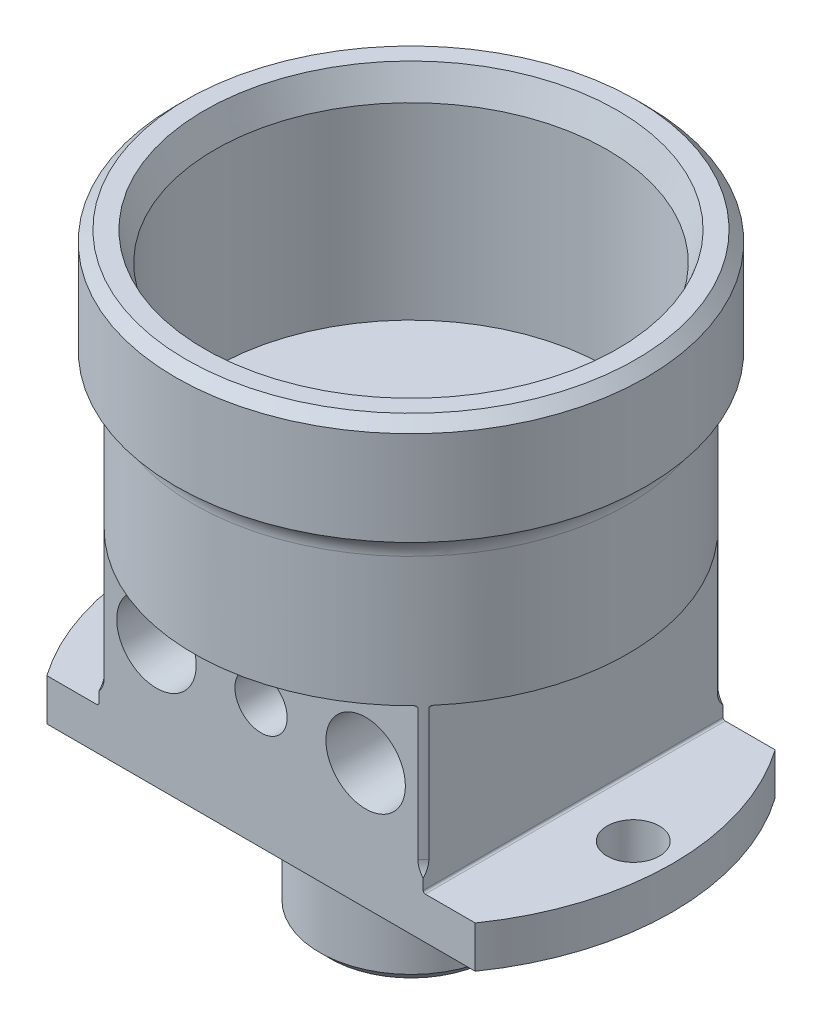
SolidWorks part; units mm, degrees
ref_plane "Front Plane" through (0, 0, 0) normal (0, 0, 1) x (1, 0, 0)
ref_plane "Top Plane" through (0, 0, 0) normal (0, 1, 0) x (1, 0, 0)
ref_plane "Right Plane" through (0, 0, 0) normal (1, 0, 0) x (0, 0, -1)
sketch "layout" plane through (0, 0, 0) normal (0, 0, 1) x (1, 0, 0)
  line L0 (0, 6.6796) -> (0, 55.0831) construction
  line L1 (0, 0) -> (26.3525, 0)
  line L2 (26.3525, 0) -> (26.3525, 43.18)
  line L3 (26.3525, 43.18) -> (26.67, 43.18)
  line L4 (28.575, 45.085) -> (28.575, 53.975)
  line L5 (26.67, 43.18) -> (28.575, 45.085)
  line L6 (26.67, 55.88) -> (25.0825, 55.88)
  line L7 (25.0825, 55.88) -> (23.8125, 52.3907)
  line L8 (23.8125, 52.3907) -> (23.8125, 29.5307)
  line L9 (23.8125, 29.5307) -> (0, 29.5307)
  line L10 (26.67, 55.88) -> (28.575, 53.975)
  line L11 (0, 29.5307) -> (0, 0)
  line L12 (4.7752, 0) -> (4.7752, -15.875)
  line L13 (3.1877, 29.5307) -> (0, 29.5307)
  line L14 (3.1877, 29.5307) -> (3.1877, 20.6407)
  line L15 (3.1877, 20.6407) -> (0, 20.6407)
  line L16 (0, 29.5307) -> (0, 20.6407)
  line L17 (3.1877, 26.9907) -> (5.5626, 26.9907)
  line L18 (3.1877, 26.9907) -> (3.1877, 23.8157)
  line L19 (3.1877, 23.8157) -> (5.5626, 23.8157)
  line L20 (5.5626, 26.9907) -> (5.5626, 23.8157)
  line L21 (0, 20.6407) -> (4.7752, 20.6407)
  line L22 (0, 20.6407) -> (0, 0)
  line L23 (0, 0) -> (4.7752, 0)
  line L24 (4.7752, 20.6407) -> (4.7752, 0)
  line L25 (4.7752, -15.875) -> (9.8171, -15.875)
  line L26 (9.8171, -15.875) -> (11.0871, -14.605)
  line L27 (11.0871, -14.605) -> (11.0871, 0)
  line L28 (11.0871, 0) -> (4.7752, 0)
  line L29 (18.2086, 0) -> (18.2086, 23.1807)
  line L30 (0, 0) -> (50.8, 0) construction
  line L31 (0, 0) -> (0, -3.81) construction
  line L32 (0, -3.81) -> (50.8, -3.81) construction
  line L33 (50.8, 0) -> (50.8, -3.81) construction
  line L34 (12.7, 15.24) -> (12.7, 21.59) construction
  line L35 (0, 15.24) -> (19.05, 15.24) construction
  line L36 (18.2086, 15.24) -> (18.2086, -3.81) construction
  line L37 (19.4786, 24.4507) -> (26.3525, 24.4507)
  line L39 (26.3525, 0) -> (31.75, 0)
  line L40 (26.3525, 0) -> (26.3525, 5.08)
  line L41 (26.3525, 5.08) -> (31.75, 5.08)
  line L42 (31.75, 0) -> (31.75, 5.08)
  line L43 (22.225, 11.43) -> (31.75, 11.43)
  line L44 (22.225, 11.43) -> (22.225, 5.08)
  line L45 (22.225, 5.08) -> (31.75, 5.08)
  line L46 (31.75, 11.43) -> (31.75, 5.08)
  line L47 (23.8125, 5.08) -> (30.1625, 5.08)
  line L48 (23.8125, 5.08) -> (23.8125, -7.62)
  line L49 (23.8125, -7.62) -> (30.1625, -7.62)
  line L50 (30.1625, 5.08) -> (30.1625, -7.62)
  line L51 (4.7752, -8.7376) -> (7.9375, -8.7376)
  line L52 (4.7752, -8.7376) -> (4.7752, -12.7)
  line L53 (4.7752, -12.7) -> (7.9375, -12.7)
  line L54 (7.9375, -8.7376) -> (7.9375, -12.7)
  line L55 (11.0871, -3.175) -> (9.0551, -3.175)
  line L56 (11.0871, -3.175) -> (11.0871, -6.731)
  line L57 (11.0871, -6.731) -> (9.0551, -6.731)
  line L58 (9.0551, -3.175) -> (9.0551, -6.731)
  circle A0 centre (12.7, 15.24) radius 4.7625
  arc A1 (18.2086, 23.1807) -> (19.4786, 24.4507) centre (19.4786, 23.1807) cw
  circle A2 centre (12.7, 15.24) radius 6.35 construction
  circle A3 centre (0, 15.24) radius 26.3525 construction
  point P24 (4.3752, 23.8157)
  point P59 (26.9875, 5.08)
  point P60 (26.9875, 5.08)
  point P62 (26.9875, 11.43)
  dimension "D25" = 9.525
  dimension "D29" = 12.7
  dimension "D30" = 1.27
  dimension "D1" = 47.625
  dimension "D2" = 55.88
  dimension "D3" = 57.15
  dimension "D4" = 1.27
  dimension "D5" = 45
  dimension "D6" = 12.7
  dimension "D7" = 20
  dimension "D8" = 22.86
  dimension "D9" = 52.705
  dimension "D10" = 45
  dimension "D11" = 26.67
  dimension "D12" = 2.54
  dimension "D13" = 9.5504
  dimension "D14" = 6.3754
  dimension "D15" = 11.1252
  dimension "D16" = 3.175
  dimension "D17" = 2.54
  dimension "D18" = 3.175
  dimension "D19" = 20.6407
  dimension "D20" = 15.875
  dimension "D21" = 45
  dimension "D22" = 1.27
  dimension "D23" = 6.3119
  dimension "D24" = 2.2968
  dimension "D26" = 25.4
  dimension "D27" = 15.24
  dimension "D28" = 3.81
  dimension "D31" = 5.08
  dimension "D32" = 22.1742
  dimension "D33" = 5.08
  dimension "D34" = 63.5
  dimension "D35" = 6.35
  dimension "D36" = 9.525
  dimension "D37" = 53.975
  dimension "D38" = 6.35
  dimension "D39" = 12.7
  dimension "D40" = 50.8
  dimension "D41" = 15.875
  dimension "D42" = 3.9624
  dimension "D43" = 3.175
  dimension "D44" = 18.1102
  dimension "D45" = 3.556
  dimension "D46" = 3.175
sketch "reference_transfer" plane through (0, 0, 0) normal (0, 1, 0) x (1, 0, 0)
  line L0 (0, 0) -> (0, -18.2086) construction
  circle A0 centre (0, 0) radius 18.2086
sketch "Sketch27" plane through (0, 0, 0) normal (0, 0, 1) x (1, 0, 0)
  line L1 (23.8125, 52.3907) -> (23.8125, 29.5307) construction
  line L3 (26.3525, 0) -> (26.3525, 43.18) construction
  line L4 (26.3525, 43.18) -> (26.67, 43.18) construction
  line L6 (28.575, 45.085) -> (28.575, 53.975) construction
  line L8 (26.67, 55.88) -> (25.0825, 55.88) construction
  line L9 (25.0825, 55.88) -> (23.8125, 52.3907) construction
  line L10 (23.8125, 29.5307) -> (0, 29.5307) construction
  line L12 (23.8125, 52.3907) -> (23.8125, 29.5307)
  line L14 (26.3525, 5.08) -> (26.3525, 43.18)
  line L15 (26.3525, 43.18) -> (28.575, 43.18)
  line L17 (28.575, 43.18) -> (28.575, 55.88)
  line L19 (28.575, 55.88) -> (25.0825, 55.88)
  line L20 (25.0825, 55.88) -> (23.8125, 52.3907)
  line L21 (23.8125, 29.5307) -> (3.1877, 29.5307)
  line L23 (4.7752, -15.875) -> (9.8171, -15.875) construction
  line L24 (9.8171, -15.875) -> (11.0871, -14.605) construction
  line L25 (11.0871, -14.605) -> (11.0871, 0) construction
  line L28 (4.7752, -15.875) -> (9.8171, -15.875)
  line L29 (9.8171, -15.875) -> (11.0871, -14.605)
  line L30 (11.0871, -14.605) -> (11.0871, 0)
  line L32 (11.0871, 0) -> (26.3525, 0)
  line L33 (3.1877, 29.5307) -> (3.1877, 20.6407) construction
  line L38 (3.1877, 29.5307) -> (3.1877, 20.6407)
  line L39 (3.1877, 20.6407) -> (4.7752, 20.6407)
  line L43 (4.7752, 20.6407) -> (4.7752, -15.875)
  line L44 (26.3525, 5.08) -> (31.75, 5.08) construction
  line L46 (31.75, 0) -> (31.75, 5.08) construction
  line L47 (26.3525, 0) -> (31.75, 0) construction
  line L48 (26.3525, 5.08) -> (31.75, 5.08)
  line L50 (31.75, 0) -> (31.75, 5.08)
  line L51 (26.3525, 0) -> (31.75, 0)
revolve "Revolve1" add sketch "Sketch27" angle 360 about L0
sketch "Sketch42" plane through (0, 0, 0) normal (0, 0, 1) x (1, 0, 0)
  line L0 (5.5626, 26.9907) -> (5.5626, 23.8157) construction
  line L1 (3.1877, 23.8157) -> (5.5626, 23.8157) construction
  line L2 (3.1877, 26.9907) -> (3.1877, 23.8157) construction
  line L3 (3.1877, 26.9907) -> (5.5626, 26.9907) construction
  line L4 (5.5626, 26.9907) -> (5.5626, 23.8157)
  line L5 (3.1877, 23.8157) -> (5.5626, 23.8157)
  line L6 (3.1877, 26.9907) -> (3.1877, 23.8157)
  line L7 (3.1877, 26.9907) -> (5.5626, 26.9907)
revolve "cup_seal_groove" cut sketch "Sketch42" angle 360 about L0
sketch "Sketch43" plane through (0, 0, 0) normal (0, 0, 1) x (1, 0, 0)
  line L0 (11.0871, -6.731) -> (9.0551, -6.731) construction
  line L1 (9.0551, -3.175) -> (9.0551, -6.731) construction
  line L2 (11.0871, -3.175) -> (9.0551, -3.175) construction
  line L3 (11.0871, -3.175) -> (11.0871, -6.731) construction
  line L4 (11.0871, -6.731) -> (9.0551, -6.731)
  line L5 (9.0551, -3.175) -> (9.0551, -6.731)
  line L6 (11.0871, -3.175) -> (9.0551, -3.175)
  line L7 (11.0871, -3.175) -> (11.0871, -6.731)
revolve "o-ring_groove" cut sketch "Sketch43" angle 360 about L0
sketch "Sketch44" plane through (0, 0, 0) normal (0, 0, 1) x (1, 0, 0)
  line L0 (7.9375, -8.7376) -> (7.9375, -12.7) construction
  line L1 (4.7752, -12.7) -> (7.9375, -12.7) construction
  line L2 (4.7752, -8.7376) -> (4.7752, -12.7) construction
  line L3 (4.7752, -8.7376) -> (7.9375, -8.7376) construction
  line L4 (7.9375, -8.7376) -> (7.9375, -12.7)
  line L5 (4.7752, -12.7) -> (7.9375, -12.7)
  line L6 (4.7752, -8.7376) -> (4.7752, -12.7)
  line L7 (4.7752, -8.7376) -> (7.9375, -8.7376)
revolve "cup_seal_groove_2" cut sketch "Sketch44" angle 360 about L0
fillet "Fillet8" radius 3.175 2 edges at (0, 5.08, -26.3525) (0, 43.18, -26.3525)
sketch "Sketch39" plane through (0, 0, 0) normal (1, 0, 0) x (0, 0, -1)
  line L1 (-69.0086, 0) -> (-18.2086, 0)
  line L2 (-69.0086, 0) -> (-69.0086, 24.4507)
  line L3 (-69.0086, 24.4507) -> (-18.2086, 24.4507)
  line L4 (-18.2086, 0) -> (-18.2086, 24.4507)
  line L5 (18.2086, 0) -> (-18.2086, 0) construction
  dimension "D1" = 50.8
extrude "Cut-Extrude3" cut sketch "Sketch39" against normal through all both and the other way through all
mirror "Mirror1" about plane through (0, 0, 0) normal (0, 0, 1) of "Cut-Extrude3"
sketch "Sketch41" plane through (0, 0, 0) normal (0, 0, 1) x (1, 0, 0)
  line L0 (19.4786, 24.4507) -> (26.3525, 24.4507) construction
  line L1 (31.75, 5.08) -> (19.685, 5.08)
  line L2 (31.75, 5.08) -> (31.75, 24.4507)
  line L3 (31.75, 24.4507) -> (19.685, 24.4507)
  line L4 (19.685, 5.08) -> (19.685, 24.4507)
  line L5 (22.225, 11.43) -> (22.225, 5.08) construction
  dimension "D1" = 2.54
extrude "Cut-Extrude5" cut sketch "Sketch41" against normal through all both and the other way through all
mirror "Mirror2" about plane through (0, 0, 0) normal (1, 0, 0) of "Cut-Extrude5"
fillet "Fillet7" radius 0.254 6 edges at (0, 24.4507, -18.2086) (0, 24.4507, 18.2086) (19.685, 24.4507, 0) (19.685, 5.08, 0) (-19.685, 24.4507, 0) (-19.685, 5.08, 0)
sketch "Sketch30" plane through (0, 0, 18.2086) normal (0, 0, -1) x (-1, 0, 0)
  line L0 (-12.7, 15.24) -> (12.7, 15.24) construction
  point P0 (-12.7, 15.24)
  point P4 (12.7, 15.24)
  point P15 (0, 15.24)
hole_wizard "1/8 NPT Tapped Hole1" positions "Sketch30" profile "Sketch31" size "1/8" standard "ANSI Inch"
sketch "Sketch31" plane through (12.7, 15.24, 18.2086) normal (1, 0, 0) x (0, -1, 0)
  line L0 (0, 0) -> (0, 20.742)
  line L1 (4.2164, 18.2086) -> (0, 20.742)
  line L2 (-4.2164, 18.2086) -> (0, 20.742) construction
  line L3 (4.2164, 18.2086) -> (4.2164, 9.652)
  line L4 (4.2164, 9.652) -> (4.5374, 9.652)
  line L5 (4.5374, 9.652) -> (4.8264, 0)
  line L6 (-4.5374, 9.652) -> (-4.8264, 0) construction
  line L7 (4.8264, 0) -> (0, 0)
  line L8 (0, -6.35) -> (0, 107.95) construction
  line L11 (-4.2164, 9.652) -> (-4.5374, 9.652) construction
  dimension "Tap Drill Dia." = 8.4328
  dimension "Tap Drill Depth" = 18.2086
  dimension "Thread Dia." = 9.6528
  dimension "Thread Angle" = 3.43
  dimension "Thread Depth" = 9.652
  dimension "Drill Angle" = 118
hole_wizard "1/4 (0.25) Diameter Hole1" positions "Sketch32" profile "Sketch33" hole size "1/4" standard "ANSI Inch"
sketch "Sketch32" plane through (0, 30.2209, 18.2086) normal (0, 0, -1) x (-1, 0, 0)
  line L0 (0, -14.9809) -> (-19.05, -14.9809) construction
  point P0 (0, -14.9809)
sketch "Sketch33" plane through (0, 15.24, 18.2086) normal (1, 0, 0) x (0, -1, 0)
  line L0 (0, 0) -> (0, 46.7836)
  line L1 (0, 46.7836) -> (3.175, 46.7836)
  line L2 (3.175, 46.7836) -> (3.175, 0)
  line L5 (3.175, 0) -> (0, 0)
  line L11 (0, -6.35) -> (0, 107.95) construction
  dimension "Thru Hole Dia." = 6.35
  dimension "Thru Hole Depth" = 46.7836
hole_wizard "1/4 (0.25) Diameter Hole2" positions "Sketch34" profile "Sketch35" hole size "1/4" standard "ANSI Inch"
sketch "Sketch34" plane through (0, 29.5307, 0) normal (0, 1, 0) x (1, 0, 0)
  line L2 (-12.7, 0) -> (12.7, 0) construction
  point P0 (-12.7, 0)
  point P4 (12.7, 0)
  point P17 (0, 0)
  dimension "D1" = 0
sketch "Sketch35" plane through (-12.7, 29.5307, 0) normal (1, 0, 0) x (0, 0, 1)
  line L0 (0, 0) -> (0, 18.4177)
  line L1 (0, 18.4177) -> (3.175, 16.51)
  line L2 (3.175, 16.51) -> (3.175, 0)
  line L5 (3.175, 0) -> (0, 0)
  line L10 (0, 18.4177) -> (-3.175, 16.51) construction
  line L11 (0, -6.35) -> (0, 107.95) construction
  dimension "Hole Dia." = 6.35
  dimension "Hole Depth" = 16.51
  dimension "Drill Angle" = 118
sketch "Sketch36" plane through (0, 0, 0) normal (0, -1, 0) x (-1, 0, 0)
  line L0 (-26.9875, 0) -> (26.9875, 0) construction
  point P0 (-26.9875, 0)
  point P2 (26.9875, 0)
  point P10 (0, 0)
  dimension "D1" = 53.975
hole_wizard "1/4 (0.25) Diameter Hole3" positions "Sketch36" profile "Sketch37" hole size "1/4" standard "ANSI Inch"
sketch "Sketch37" plane through (26.9875, 0, 0) normal (1, 0, 0) x (0, 0, -1)
  line L0 (0, 0) -> (0, 18.4177)
  line L1 (0, 18.4177) -> (3.175, 16.51)
  line L2 (3.175, 16.51) -> (3.175, 0)
  line L5 (3.175, 0) -> (0, 0)
  line L10 (0, 18.4177) -> (-3.175, 16.51) construction
  line L11 (0, -6.35) -> (0, 107.95) construction
  dimension "Hole Dia." = 6.35
  dimension "Hole Depth" = 16.51
  dimension "Drill Angle" = 118
other "2-1/4-12 Machine Threads Stud1" parameters "D1"=57.15, "D2"=10, "D3"=12.7, "D4"=57.15
sketch "Sketch45" plane through (0, 55.88, 0) normal (1, 0, 0) x (0, 0, -1)
  line L5 (0, -14.3089) -> (0, 0) construction
  line L6 (27.3152, 0) -> (28.575, -1.2598)
  line L9 (28.575, -1.2598) -> (28.575, -12.7) construction
  line L10 (27.3152, 0) -> (28.575, 0)
  line L13 (28.575, -1.2598) -> (28.575, 0)
  dimension "Minor Diameter" = 54.6303
  dimension "Major Diameter" = 57.15
  dimension "Thread Length" = 12.7
  dimension "Chamfer Angle" = 45
chamfer "Chamfer1" [suppressed] distance 1.27 angle 45
thread "Thread1" pitch 2.1167 start angle 0, offset 5.08, length 17.78, pitch 2.1167, diameter 57.15
ref_plane "Plane1" through (-28.575, 59.69, 0) normal (0, 0, 1) x (-1, 0, 0)
sketch "Thread Profile1" plane through (-28.575, 59.69, 0) normal (0, 0, 1) x (-1, 0, 0)
  line L0 (0, 0) -> (0, 2.1167) construction
  line L11 (0, 0) -> (0, 1.8521)
  line L12 (0, 1.8521) -> (-1.1457, 1.1906)
  line L13 (-1.1457, 1.1906) -> (-1.1457, 0.6615)
  line L15 (-1.1457, 0.6615) -> (0, 0)
  line L17 (-1.1457, 0.926) -> (0, 0.926) construction
  point P2 (0, 0)
  dimension "Pitch" = 2.1167
  dimension "Profile_Angle" = 60
  dimension "Profile_Land" = 0.5292
  dimension "Profile_Height" = 1.1457
fillet "Fillet9" radius 0.254 1 edges at (0, 0, -11.0871)
fillet "oring1_inner_radius" radius 0.381 2 edges at (0, -6.731, -9.0551) (0, -3.175, -9.0551)
fillet "oring1_break_radius" radius 0.127 2 edges at (0, -6.731, -11.0871) (0, -3.175, -11.0871)
fillet "Fillet12" radius 0.127 2 edges at (0, 26.9907, -3.1877) (0, 29.5307, -3.1877)
fillet "Fillet13" radius 0.127 2 edges at (0, -15.875, -4.7752) (0, -12.7, -4.7752)
chamfer "Chamfer2" distance 1.27 angle 45 1 edges at (0, 20.6407, -4.7752)
